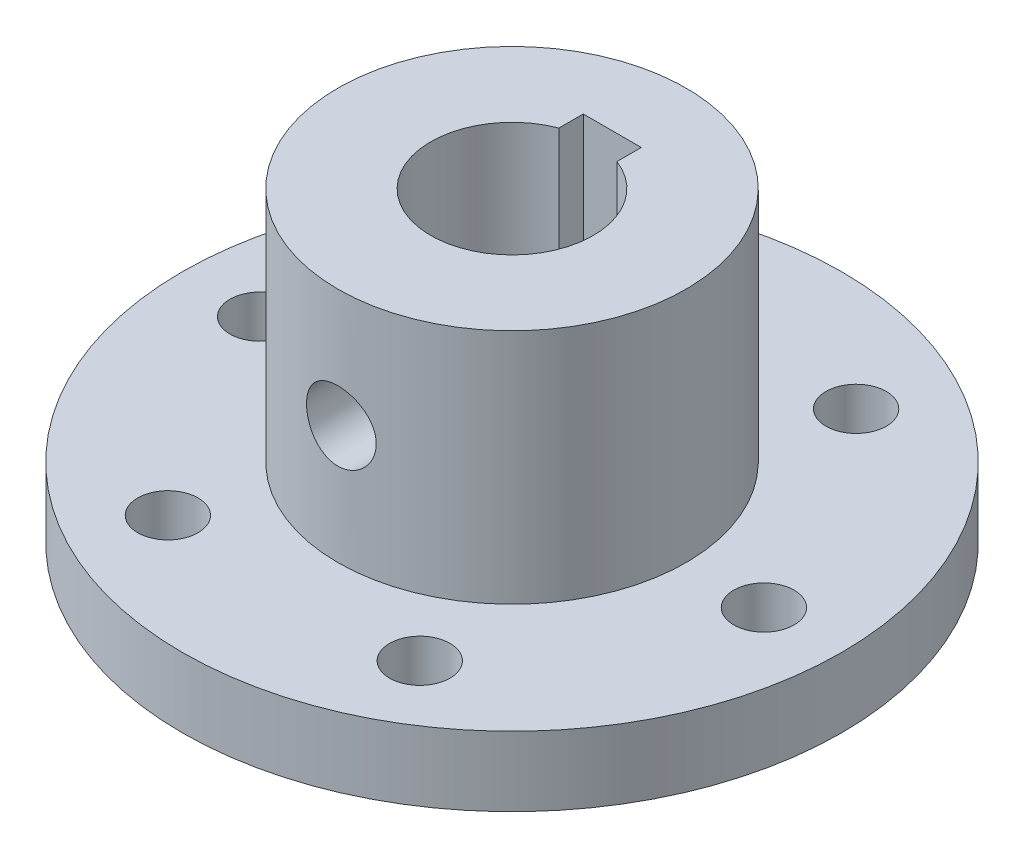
SolidWorks part; units mm, degrees
ref_plane "Front Plane" through (0, 0, 0) normal (0, 0, 1) x (1, 0, 0)
ref_plane "Top Plane" through (0, 0, 0) normal (0, 1, 0) x (1, 0, 0)
ref_plane "Right Plane" through (0, 0, 0) normal (1, 0, 0) x (0, 0, -1)
sketch "Sketch1" plane through (0, 0, 0) normal (0, 1, 0) x (1, 0, 0)
  circle A0 centre (0, 0) radius 28.4
  dimension "D1" = 56.8
extrude "Boss-Extrude1" add sketch "Sketch1" along normal blind 6
sketch "Sketch2" plane through (0, 6, 0) normal (0, 1, 0) x (1, 0, 0)
  circle A0 centre (0, 0) radius 15
  dimension "D1" = 30
extrude "Boss-Extrude2" add sketch "Sketch2" along normal blind 20.4
sketch "Sketch3" plane through (0, 26.4, 0) normal (0, 1, 0) x (1, 0, 0)
  line L1 (-2.5, 8.6383) -> (2.5, 8.6383)
  line L2 (-2.5, 8.6383) -> (-2.5, 6.5383)
  line L4 (2.5, 8.6383) -> (2.5, 6.5383)
  line L5 (-2.5, 8.6383) -> (2.5, 6.5383) construction
  line L6 (-2.5, 6.5383) -> (2.5, 8.6383) construction
  arc A0 (-2.5, 6.5383) -> (2.5, 6.5383) centre (0, 0) ccw
  point P7 (0, 7.5883)
  point P8 (0, 0)
  point P9 (0, 0)
  point P10 (0, 8.6383)
  dimension "D1" = 14
  dimension "D2" = 5
  dimension "D3" = 2.1
extrude "Cut-Extrude1" cut sketch "Sketch3" against normal through all
sketch "Sketch4" plane through (0, 0, 0) normal (0, 0, 1) x (1, 0, 0)
  line L0 (7, 26.4) -> (-7, 26.4) construction
  line L1 (0, 0) -> (0, 16.2) construction
  circle A0 centre (0, 16.2) radius 3
  dimension "D1" = 6
  dimension "D2" = 10.2
extrude "Cut-Extrude2" cut sketch "Sketch4" along normal through all
sketch "Sketch5" plane through (0, 6, 0) normal (0, 1, 0) x (1, 0, 0)
  line L0 (-21.7, 0) -> (-28.4, 0) construction
  line L1 (-21.7, 0) -> (-15, 0) construction
  line L2 (-21.7, 0) -> (-21.7, 18.3213) construction
  line L3 (-21.7, 0) -> (-21.7, -18.3213) construction
  circle A0 centre (-21.7, 0) radius 2.6
  circle A1 centre (0, 0) radius 28.4 construction
  circle A2 centre (0, 0) radius 15 construction
  dimension "D1" = 5.2
extrude "Cut-Extrude3" cut sketch "Sketch5" against normal through all
pattern_circular "CirPattern1" count 6 over 360 about axis through (0, 0, 0) along (0, 1, 0) of "Cut-Extrude3"
